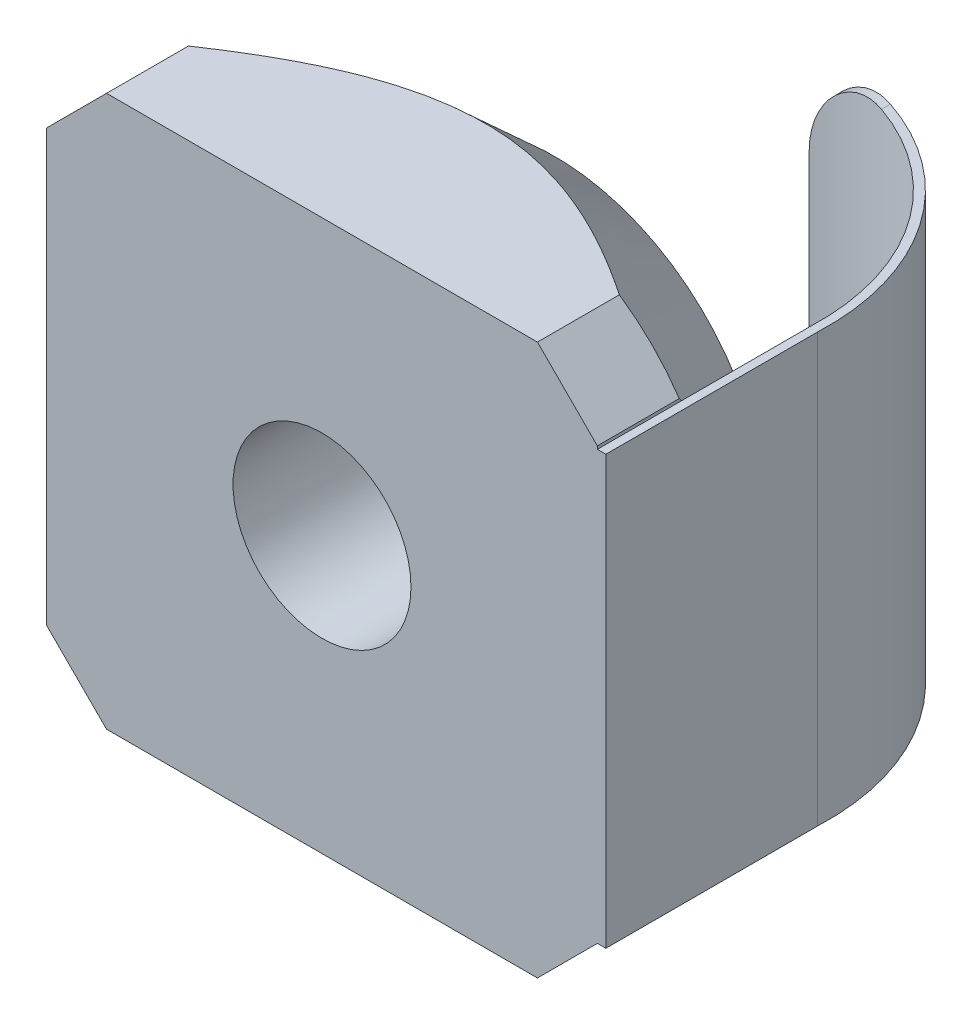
SolidWorks part; units mm, degrees
ref_plane "Front" through (0, 0, 0) normal (0, 0, 1) x (1, 0, 0)
ref_plane "Top" through (0, 0, 0) normal (0, 1, 0) x (1, 0, 0)
ref_plane "Right" through (0, 0, 0) normal (1, 0, 0) x (0, 0, -1)
imported_body "Imported1"
hole_wizard "M5x0.8 Tapped Hole1" positions "3DSketch1" profile "Sketch1" tap size "M5x0.8" standard "Ansi Metric"
sketch3d "3DSketch1"
  line L0 (-6.5, 5.0858, 0) -> (-6.5, -5.0858, 0) construction
  line L1 (5.0858, 6.5, 0) -> (-5.0858, 6.5, 0) construction
  point P0 (0, 0, 0)
  dimension "D1" = 6.5
  dimension "D2" = 6.5
sketch "Sketch1" plane through (0, 0, 0) normal (1, 0, 0) x (0, -1, 0)
  line L0 (0, 0) -> (0, 7.2618)
  line L1 (0, 7.2618) -> (2.1, 6)
  line L2 (2.1, 6) -> (2.1, 0)
  line L5 (2.1, 0) -> (0, 0)
  line L10 (0, 7.2618) -> (-2.1, 6) construction
  line L11 (0, -6.35) -> (0, 107.95) construction
  dimension "Tap Drill Dia." = 4.2
  dimension "Tap Drill Depth" = 6
  dimension "Drill Angle" = 118
